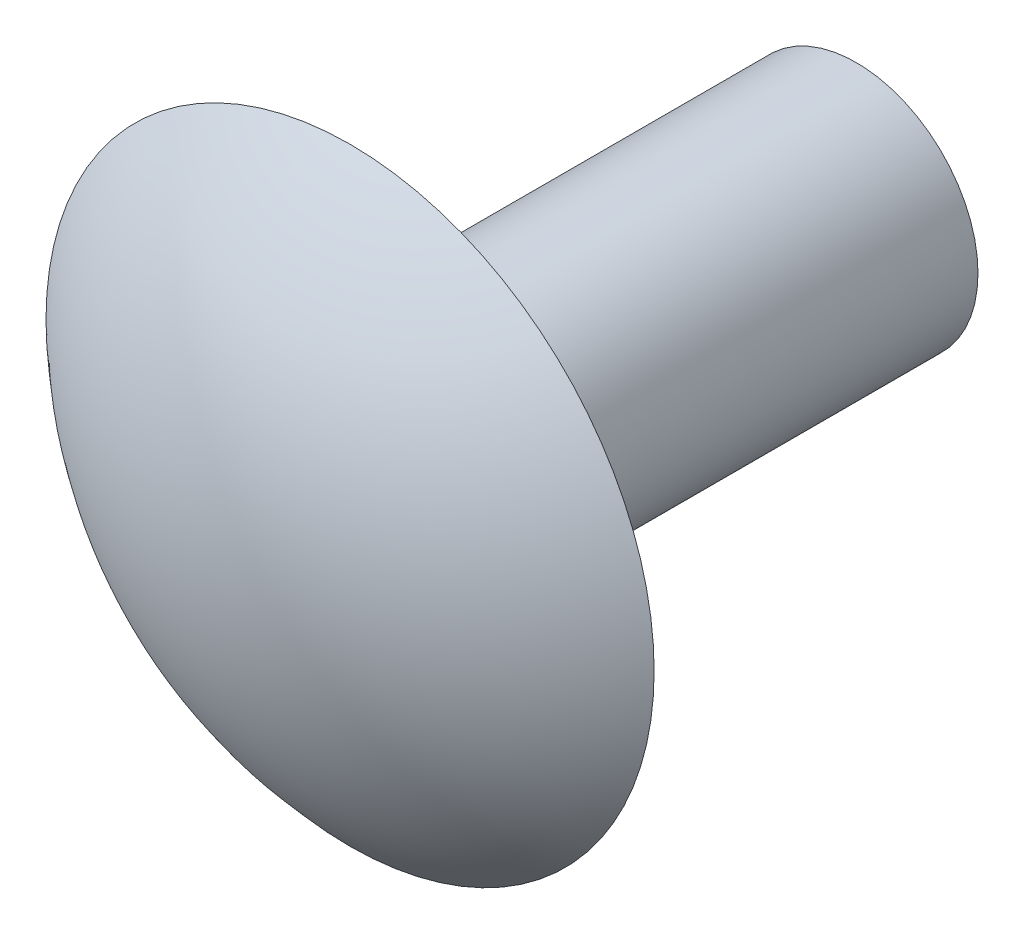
SolidWorks part; units mm, degrees
ref_plane "Front Plane" through (0, 0, 0) normal (1, 0, 0) x (0, 1, 0)
ref_plane "Top Plane" through (0, 0, 0) normal (0, 0, 1) x (0, 1, 0)
ref_plane "Right Plane" through (0, 0, 0) normal (0, 1, 0) x (-1, 0, 0)
sketch "head dia" plane through (0, 0, 0) normal (0, 0, 1) x (0, 1, 0)
  circle A0 centre (0, 0) radius 11.8999
  dimension "D1" = 23.7998
sketch "shank dia" plane through (0, 0, 0) normal (0, 0, 1) x (0, 1, 0)
  circle A0 centre (0, 0) radius 4.7625
  dimension "D1" = 9.525
extrude "Rivet head" add sketch "head dia" along normal blind 4.7498
sketch "Sketch3" plane through (0, 0, 0) normal (1, 0, 0) x (0, 1, 0)
  line L0 (0, 0) -> (0, 4.7498) construction
  line L1 (11.8999, 4.7498) -> (-11.8999, 4.7498) construction
  line L2 (0, 4.7498) -> (0, 6.0091)
  line L3 (0, 6.0091) -> (12.6316, 6.0091)
  line L4 (12.6316, 6.0091) -> (12.6316, 0)
  line L5 (12.6316, 0) -> (11.8999, 0)
  arc A0 (0, 4.7498) -> (11.8999, 0) centre (0.0038, -12.5222) cw
  dimension "D1" = 17.272
revolve "dome cut" cut sketch "Sketch3" angle 360 about L0
extrude "Rivet Length" add sketch "shank dia" against normal blind 19.812
